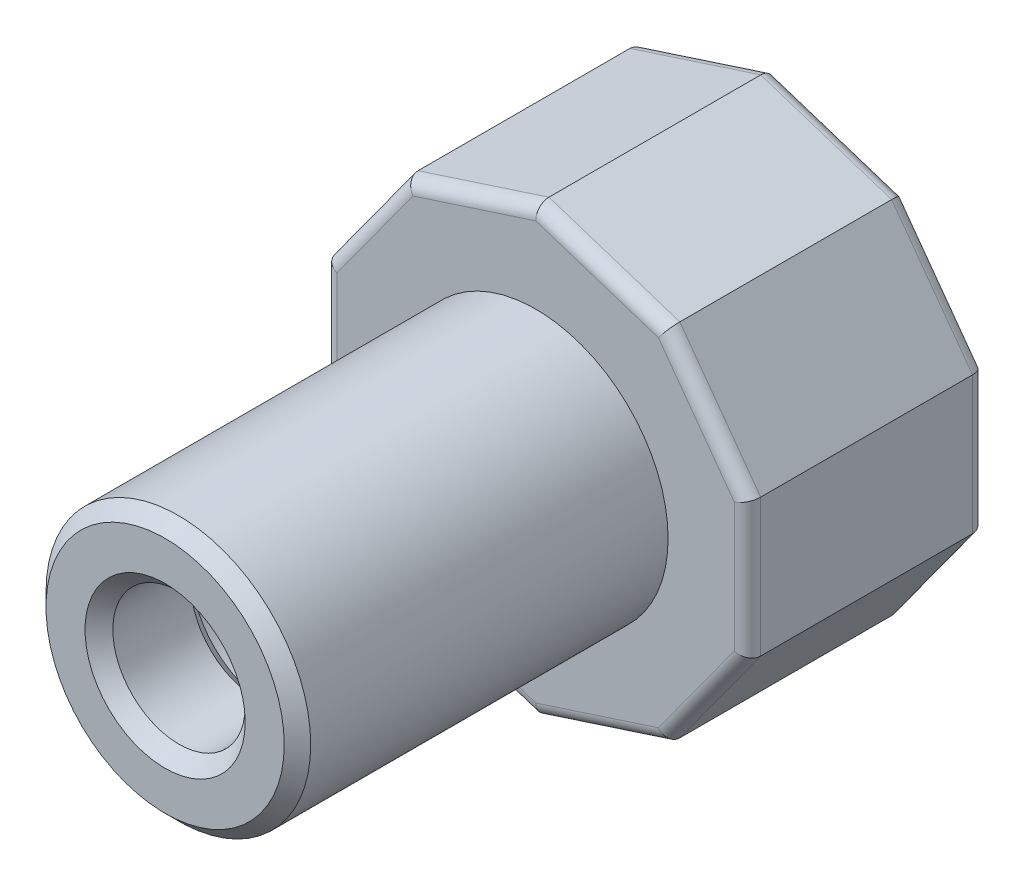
SolidWorks part; units mm, degrees
ref_plane "Front" through (0, 0, 0) normal (0, 0, 1) x (1, 0, 0)
ref_plane "Top" through (0, 0, 0) normal (0, 1, 0) x (1, 0, 0)
ref_plane "Right" through (0, 0, 0) normal (1, 0, 0) x (0, 0, -1)
sketch "Esquisse1" plane through (0, 0, 0) normal (0, 0, 1) x (1, 0, 0)
  line L0 (0, 0) -> (8, 0) construction
  line L1 (4.9443, -6.8052) -> (8, -2.5994)
  line L2 (8, -2.5994) -> (8, 2.5994)
  line L3 (8, 2.5994) -> (4.9443, 6.8052)
  line L4 (4.9443, 6.8052) -> (0, 8.4117)
  line L5 (0, 8.4117) -> (-4.9443, 6.8052)
  line L6 (-4.9443, 6.8052) -> (-8, 2.5994)
  line L7 (-8, 2.5994) -> (-8, -2.5994)
  line L8 (-8, -2.5994) -> (-4.9443, -6.8052)
  line L9 (-4.9443, -6.8052) -> (0, -8.4117)
  line L10 (0, -8.4117) -> (4.9443, -6.8052)
  circle A0 centre (0, 0) radius 8 construction
  dimension "D1" = 16
extrude "Boss.-Extru.1" add sketch "Esquisse1" along normal blind 9
sketch "Esquisse2" plane through (0, 0, 9) normal (0, 0, 1) x (1, 0, 0)
  circle A0 centre (0, 0) radius 5
  dimension "D1" = 10
extrude "Boss.-Extru.2" add sketch "Esquisse2" along normal blind 14
sketch "Esquisse3" plane through (0, 0, 0) normal (0, 0, -1) x (-1, 0, 0)
  circle A0 centre (0, 0) radius 3.375
  dimension "D1" = 6.75
extrude "Enlèv. mat.-Extru.1" cut sketch "Esquisse3" against normal blind 19
hole_wizard "Trou taraudé M61" positions "Esquisse4" profile "Esquisse5" tap size "M6" standard "ISO"
sketch "Esquisse4" plane through (0, 0, 23) normal (0, 0, 1) x (1, 0, 0)
  point P0 (0, 0)
sketch "Esquisse5" plane through (0, 0, 23) normal (1, 0, 0) x (0, -1, 0)
  line L0 (0, 0) -> (0, 4)
  line L1 (0, 4) -> (3.025, 4)
  line L2 (2.5, 3.475) -> (2.5, 0.525)
  line L3 (2.5, 0.525) -> (3.025, 0)
  line L5 (3.025, 0) -> (0, 0)
  line L6 (-2.5, 0.525) -> (-3.025, 0) construction
  line L7 (3.025, 4) -> (2.5, 3.475)
  line L8 (-3.025, 4) -> (-2.5, 3.475) construction
  line L11 (0, -6.35) -> (0, 107.95) construction
  dimension "Diamètre du trou pour taraudage jusqu'au prochain" = 5
  dimension "Profondeur du trou pour taraudage jusqu'au prochain" = 4
  dimension "Diamètre du fraisage entrant" = 6.05
  dimension "Angle du fraisage entrant" = 90
  dimension "Diamètre du fraisage débouchant" = 6.05
  dimension "Angle du fraisage débouchant" = 90
chamfer "Chanfrein1" distance 0.5 angle 45 2 edges at (5, 0, 23) (-3.375, 0, 0)
fillet "Congé1" radius 0.5 20 edges at (-2.4721, -7.6085, 9) (-6.4721, -4.7023, 9) (-8, 0, 9) (-6.4721, 4.7023, 9) (-2.4721, 7.6085, 9) (2.4721, -7.6085, 9) (6.4721, -4.7023, 9) (2.4721, 7.6085, 9) (6.4721, 4.7023, 9) (8, 0, 9) (8, 0, 0) (6.4721, -4.7023, 0) (2.4721, -7.6085, 0) (-2.4721, -7.6085, 0) (-6.4721, -4.7023, 0) (-8, 0, 0) (-6.4721, 4.7023, 0) (-2.4721, 7.6085, 0) (2.4721, 7.6085, 0) (6.4721, 4.7023, 0)
